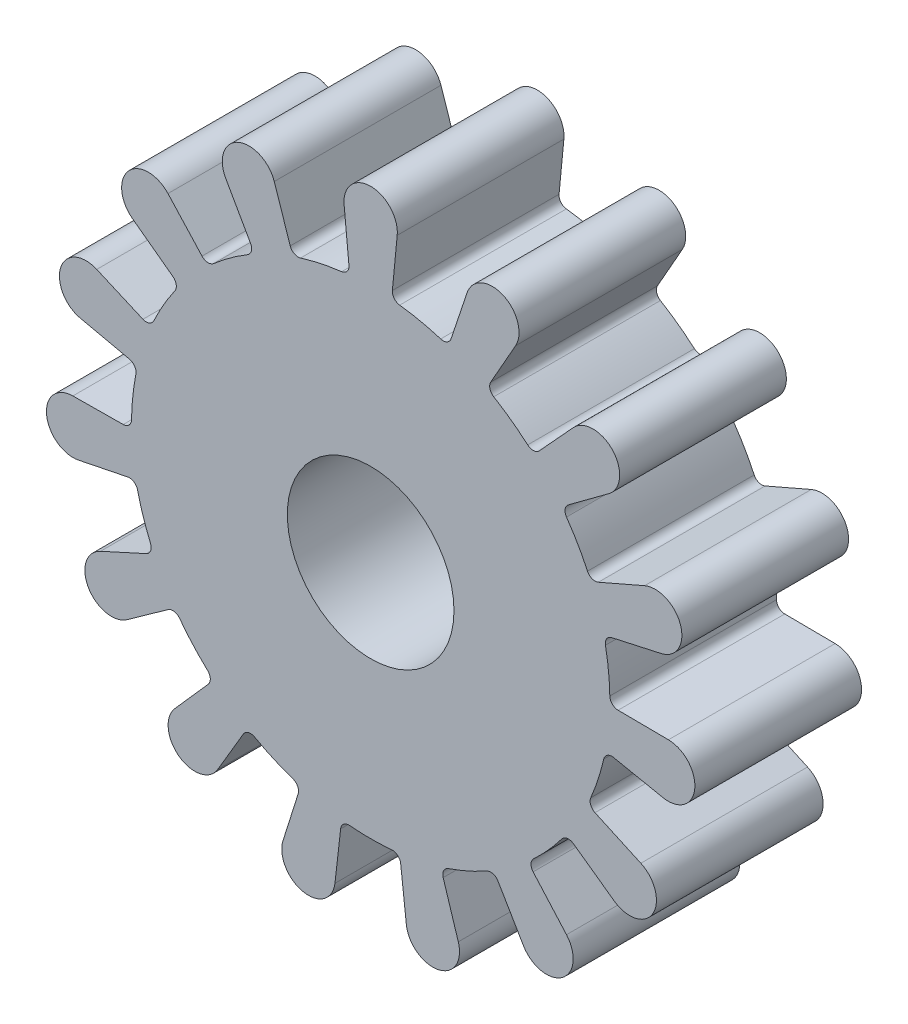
SolidWorks part; units mm, degrees
ref_plane "Спереди" through (0, 0, 0) normal (0, 0, 1) x (1, 0, 0)
ref_plane "Сверху" through (0, 0, 0) normal (0, 1, 0) x (1, 0, 0)
ref_plane "Справа" through (0, 0, 0) normal (1, 0, 0) x (0, 0, -1)
sketch "Эскиз1" plane through (0, 0, 0) normal (0, 0, 1) x (1, 0, 0)
  line L0 (0, 22.5969) -> (0, 0) construction
  line L1 (0, 0) -> (19.55, 0) construction
  line L2 (-1.5926, 17.7966) -> (-1.303, 14.7883)
  line L3 (1.5926, 17.7966) -> (1.303, 14.7883)
  line L4 (5.7836, 16.9058) -> (4.8246, 14.0398)
  line L5 (8.6935, 15.6103) -> (7.2053, 12.9799)
  line L6 (12.1598, 13.0918) -> (10.118, 10.8636)
  line L7 (14.2912, 10.7247) -> (11.8617, 8.927)
  line L8 (16.4335, 7.0142) -> (13.6619, 5.809)
  line L9 (17.4178, 3.9848) -> (14.4672, 3.3307)
  line L10 (17.8656, -0.2763) -> (14.8435, -0.25)
  line L11 (17.5327, -3.4442) -> (14.5711, -2.8416)
  line L12 (16.2087, -7.5191) -> (13.4586, -6.2658)
  line L13 (14.616, -10.2776) -> (12.1556, -8.5226)
  line L14 (11.7491, -13.4617) -> (9.7465, -11.1982)
  line L15 (9.1721, -15.3339) -> (7.6382, -12.7299)
  line L16 (5.258, -17.0766) -> (4.3492, -14.1943)
  line L17 (2.1423, -17.7389) -> (1.8002, -14.7361)
  line L18 (-2.1423, -17.7389) -> (-1.8002, -14.7361)
  line L19 (-5.258, -17.0766) -> (-4.3492, -14.1943)
  line L20 (-9.1721, -15.3339) -> (-7.6382, -12.7299)
  line L21 (-11.7491, -13.4617) -> (-9.7465, -11.1982)
  line L22 (-14.616, -10.2776) -> (-12.1556, -8.5226)
  line L23 (-16.2087, -7.5191) -> (-13.4586, -6.2658)
  line L24 (-17.5327, -3.4442) -> (-14.5711, -2.8416)
  line L25 (-17.8656, -0.2763) -> (-14.8435, -0.25)
  line L26 (-17.4178, 3.9848) -> (-14.4672, 3.3307)
  line L27 (-16.4335, 7.0142) -> (-13.6619, 5.809)
  line L28 (-14.2912, 10.7247) -> (-11.8617, 8.927)
  line L29 (-12.1598, 13.0918) -> (-10.118, 10.8636)
  line L30 (-8.6935, 15.6103) -> (-7.2053, 12.9799)
  line L31 (-5.7836, 16.9058) -> (-4.8246, 14.0398)
  circle A0 centre (0, 0) radius 5
  circle A1 centre (0, 0) radius 19.55 construction
  arc A2 (-1.74, 14.2441) -> (-4.204, 13.7204) centre (0, 0) ccw
  arc A3 (1.5926, 17.7966) -> (-1.5926, 17.7966) centre (0, 17.95) ccw
  arc A4 (8.6935, 15.6103) -> (5.7836, 16.9058) centre (7.3009, 16.3981) ccw
  arc A5 (14.2912, 10.7247) -> (12.1598, 13.0918) centre (13.3394, 12.0109) ccw
  arc A6 (17.4178, 3.9848) -> (16.4335, 7.0142) centre (17.0715, 5.5469) ccw
  arc A7 (17.5327, -3.4442) -> (17.8656, -0.2763) centre (17.8517, -1.8763) ccw
  arc A8 (14.616, -10.2776) -> (16.2087, -7.5191) centre (15.5452, -8.975) ccw
  arc A9 (9.1721, -15.3339) -> (11.7491, -13.4617) centre (10.5507, -14.5219) ccw
  arc A10 (2.1423, -17.7389) -> (5.258, -17.0766) centre (3.732, -17.5577) ccw
  arc A11 (-5.258, -17.0766) -> (-2.1423, -17.7389) centre (-3.732, -17.5577) ccw
  arc A12 (-11.7491, -13.4617) -> (-9.1721, -15.3339) centre (-10.5507, -14.5219) ccw
  arc A13 (-16.2087, -7.5191) -> (-14.616, -10.2776) centre (-15.5452, -8.975) ccw
  arc A14 (-17.8656, -0.2763) -> (-17.5327, -3.4442) centre (-17.8517, -1.8763) ccw
  arc A15 (-16.4335, 7.0142) -> (-17.4178, 3.9848) centre (-17.0715, 5.5469) ccw
  arc A16 (-12.1598, 13.0918) -> (-14.2912, 10.7247) centre (-13.3394, 12.0109) ccw
  arc A17 (-5.7836, 16.9058) -> (-8.6935, 15.6103) centre (-7.3009, 16.3981) ccw
  arc A18 (-7.3832, 12.3049) -> (-9.4211, 10.8243) centre (0, 0) ccw
  arc A19 (-11.7498, 8.2381) -> (-13.0093, 6.0565) centre (0, 0) ccw
  arc A20 (-14.0847, 2.7468) -> (-14.348, 0.2416) centre (0, 0) ccw
  arc A21 (-13.9842, -3.2194) -> (-13.2058, -5.6151) centre (0, 0) ccw
  arc A22 (-11.4657, -8.629) -> (-9.7802, -10.501) centre (0, 0) ccw
  arc A23 (4.204, 13.7204) -> (1.74, 14.2441) centre (0, 0) ccw
  arc A24 (9.4211, 10.8243) -> (7.3832, 12.3049) centre (0, 0) ccw
  arc A25 (13.0093, 6.0565) -> (11.7498, 8.2381) centre (0, 0) ccw
  arc A26 (14.348, 0.2416) -> (14.0847, 2.7468) centre (0, 0) ccw
  arc A27 (13.2058, -5.6151) -> (13.9842, -3.2194) centre (0, 0) ccw
  arc A28 (9.7802, -10.501) -> (11.4657, -8.629) centre (0, 0) ccw
  arc A29 (4.6635, -13.5711) -> (6.9648, -12.5465) centre (0, 0) ccw
  arc A30 (-1.2595, -14.2946) -> (1.2595, -14.2946) centre (0, 0) ccw
  arc A31 (-6.9648, -12.5465) -> (-4.6635, -13.5711) centre (0, 0) ccw
  arc A32 (-13.6619, 5.809) -> (-13.0093, 6.0565) centre (-13.4625, 6.2676) ccw
  arc A33 (-14.4672, 3.3307) -> (-14.0847, 2.7468) centre (-14.5754, 2.8425) cw
  arc A34 (-14.8435, -0.25) -> (-14.348, 0.2416) centre (-14.8479, 0.25) ccw
  arc A35 (-14.5711, -2.8416) -> (-13.9842, -3.2194) centre (-14.4715, -3.3316) cw
  arc A36 (-13.4586, -6.2658) -> (-13.2058, -5.6151) centre (-13.6659, -5.8108) ccw
  arc A37 (-12.1556, -8.5226) -> (-11.4657, -8.629) centre (-11.8652, -8.9296) cw
  arc A38 (-9.7465, -11.1982) -> (-9.7802, -10.501) centre (-10.121, -10.8668) ccw
  arc A39 (-7.6382, -12.7299) -> (-6.9648, -12.5465) centre (-7.2074, -12.9837) cw
  arc A40 (-4.3492, -14.1943) -> (-4.6635, -13.5711) centre (-4.826, -14.0439) ccw
  arc A41 (-1.8002, -14.7361) -> (-1.2595, -14.2946) centre (-1.3034, -14.7927) cw
  arc A42 (1.8002, -14.7361) -> (1.2595, -14.2946) centre (1.3034, -14.7927) ccw
  arc A43 (4.3492, -14.1943) -> (4.6635, -13.5711) centre (4.826, -14.0439) cw
  arc A44 (7.6382, -12.7299) -> (6.9648, -12.5465) centre (7.2074, -12.9837) ccw
  arc A45 (9.7465, -11.1982) -> (9.7802, -10.501) centre (10.121, -10.8668) cw
  arc A46 (12.1556, -8.5226) -> (11.4657, -8.629) centre (11.8652, -8.9296) ccw
  arc A47 (13.4586, -6.2658) -> (13.2058, -5.6151) centre (13.6659, -5.8108) cw
  arc A48 (14.5711, -2.8416) -> (13.9842, -3.2194) centre (14.4715, -3.3316) ccw
  arc A49 (14.4672, 3.3307) -> (14.0847, 2.7468) centre (14.5754, 2.8425) ccw
  arc A50 (13.6619, 5.809) -> (13.0093, 6.0565) centre (13.4625, 6.2676) cw
  arc A51 (11.8617, 8.927) -> (11.7498, 8.2381) centre (12.1592, 8.5251) ccw
  arc A52 (10.118, 10.8636) -> (9.4211, 10.8243) centre (9.7494, 11.2014) cw
  arc A53 (7.2053, 12.9799) -> (7.3832, 12.3049) centre (7.6405, 12.7337) ccw
  arc A54 (-11.8617, 8.927) -> (-11.7498, 8.2381) centre (-12.1592, 8.5251) cw
  arc A55 (-10.118, 10.8636) -> (-9.4211, 10.8243) centre (-9.7494, 11.2014) ccw
  arc A56 (-7.2053, 12.9799) -> (-7.3832, 12.3049) centre (-7.6405, 12.7337) cw
  arc A57 (4.8246, 14.0398) -> (4.204, 13.7204) centre (4.3505, 14.1984) cw
  arc A58 (1.303, 14.7883) -> (1.74, 14.2441) centre (1.8007, 14.7404) ccw
  arc A59 (-1.303, 14.7883) -> (-1.74, 14.2441) centre (-1.8007, 14.7404) cw
  arc A60 (-4.8246, 14.0398) -> (-4.204, 13.7204) centre (-4.3505, 14.1984) ccw
  arc A61 (14.8435, -0.25) -> (14.348, 0.2416) centre (14.8479, 0.25) cw
  point P135 (1.2555, 14.295)
  point P138 (-1.2555, 14.295)
  dimension "D1" = 10
  dimension "D2" = 39.1
  dimension "D3" = 28.7
  dimension "D4" = 3.2
  dimension "D7" = 0.5
  dimension "D8" = 0.5
  dimension "D5" = 11
  dimension "D9" = 7.464
  dimension "D6" = 15
extrude "Бобышка-Вытянуть1" add sketch "Эскиз1" along normal blind 10
